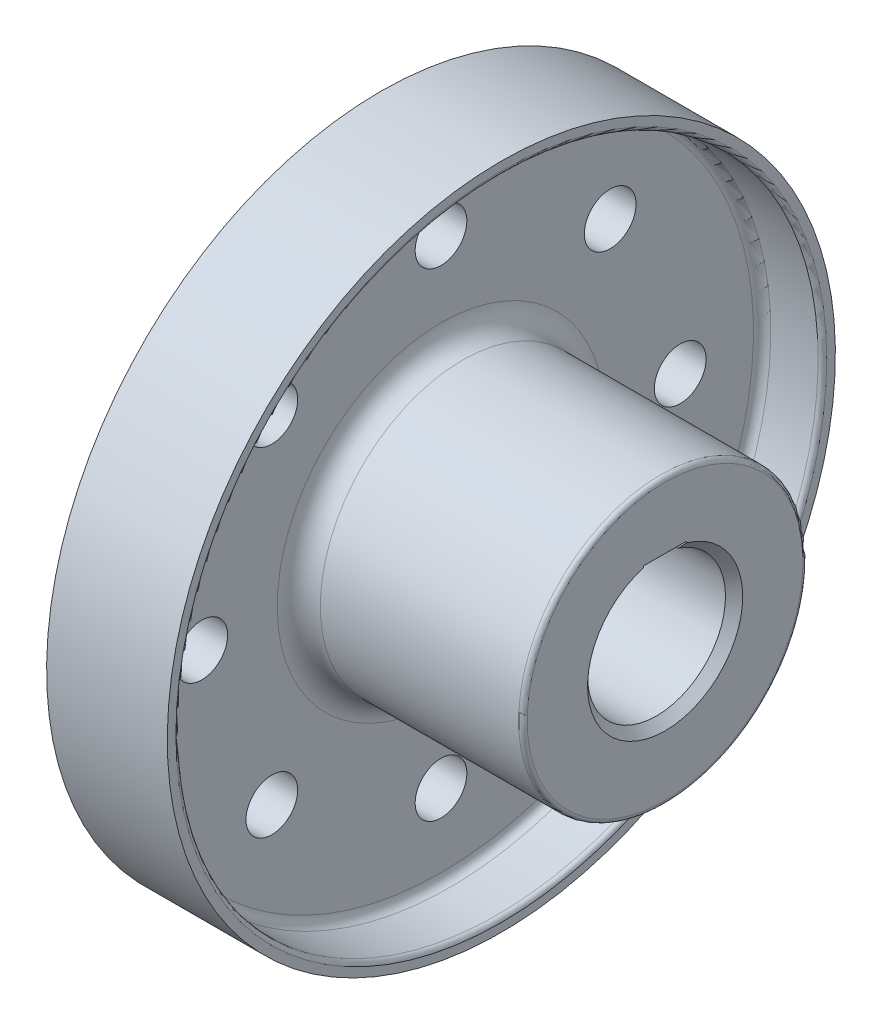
SolidWorks part; units mm, degrees
ref_plane "Front Plane" through (0, 0, 0) normal (0, 0, 1) x (1, 0, 0)
ref_plane "Top Plane" through (0, 0, 0) normal (0, 1, 0) x (1, 0, 0)
ref_plane "Right Plane" through (0, 0, 0) normal (1, 0, 0) x (0, 0, -1)
sketch "Sketch1" plane through (0, 0, 0) normal (0, 0, 1) x (1, 0, 0)
  line L0 (7.1916, 0) -> (-58.8084, 0) construction
  line L1 (7.1916, 0) -> (7.1916, 33)
  line L2 (7.1916, 33) -> (-44.8084, 33)
  line L3 (-44.8084, 33) -> (-44.8084, 74.5)
  line L4 (-44.8084, 74.5) -> (-30.8084, 74.5)
  line L5 (-30.8084, 74.5) -> (-30.8084, 77.5)
  line L6 (-30.8084, 77.5) -> (-58.8084, 77.5)
  line L7 (-58.8084, 77.5) -> (-58.8084, 0)
  line L8 (-58.8084, 0) -> (7.1916, 0)
  dimension "D1" = 77.5
  dimension "D2" = 33
  dimension "D3" = 3
  dimension "D4" = 14
  dimension "D5" = 28
  dimension "D6" = 38
revolve "Revolve1" add sketch "Sketch1" angle 360 about L0
sketch "Sketch2" plane through (-58.8084, 0, 0) normal (-1, 0, 0) x (0, 0, 1)
  circle A0 centre (0, 0) radius 27.5
  dimension "D1" = 55
extrude "Cut-Extrude1" cut sketch "Sketch2" against normal blind 6
sketch "Sketch3" plane through (-52.8084, 0, 0) normal (-1, 0, 0) x (0, 0, 1)
  line L1 (-5, 17.65) -> (5, 17.65)
  line L2 (-5, 17.65) -> (-5, 14.35)
  line L3 (-5, 14.35) -> (5, 14.35)
  line L4 (5, 17.65) -> (5, 14.35)
  line L5 (-5, 17.65) -> (5, 14.35) construction
  line L6 (-5, 14.35) -> (5, 17.65) construction
  circle A0 centre (0, 0) radius 16
  point P3 (0, 16)
  dimension "D1" = 32
  dimension "D2" = 10
  dimension "D3" = 17.65
extrude "Cut-Extrude2" cut sketch "Sketch3" against normal through all contours L2 A0 L4 L3
chamfer "Chamfer1" distance 2 angle 45 1 edges at (7.1916, -16, 0)
fillet "Fillet1" radius 1 2 edges at (-30.8084, 74.5, 0) (7.1916, 33, 0)
fillet "Fillet2" radius 2 1 edges at (-44.8084, 74.5, 0)
fillet "Fillet3" radius 5 1 edges at (-44.8084, 33, 0)
sketch "Sketch4" plane through (-58.8084, 0, 0) normal (-1, 0, 0) x (0, 0, 1)
  line L0 (0, 0) -> (0, 109.3895) construction
  circle A0 centre (0, 55.5) radius 6
  circle A1 centre (39.2444, 39.2444) radius 6
  circle A2 centre (55.5, 0) radius 6
  circle A3 centre (39.2444, -39.2444) radius 6
  circle A4 centre (0, -55.5) radius 6
  circle A5 centre (-39.2444, -39.2444) radius 6
  circle A6 centre (-55.5, 0) radius 6
  circle A7 centre (-39.2444, 39.2444) radius 6
  point P21 (0, 0)
  dimension "D1" = 12
  dimension "D2" = 55.5
  dimension "D3" = 8
extrude "Cut-Extrude3" cut sketch "Sketch4" against normal through all
